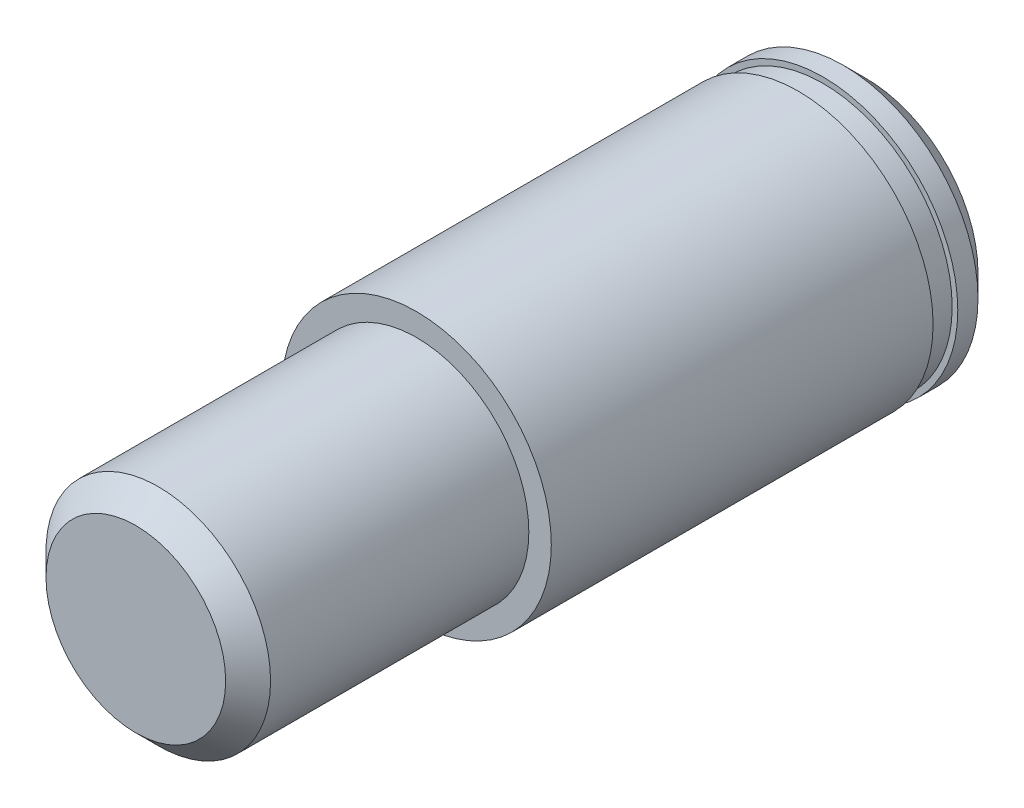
SolidWorks part; units mm, degrees
ref_plane "face" through (0, 0, 0) normal (0, 0, 1) x (1, 0, 0)
ref_plane "dessus" through (0, 0, 0) normal (0, 1, 0) x (1, 0, 0)
ref_plane "profil" through (0, 0, 0) normal (1, 0, 0) x (0, 0, -1)
sketch "Esquisse1" plane through (0, 0, 0) normal (0, 0, 1) x (1, 0, 0)
  circle A0 centre (0, 0) radius 6
  dimension "D1" = 12
extrude "Base-Extrusion" add sketch "Esquisse1" along normal blind 1.9
sketch "Esquisse2" plane through (0, 0, 1.9) normal (0, 0, 1) x (1, 0, 0)
  circle A0 centre (0, 0) radius 5.75
  dimension "D1" = 11.5
extrude "Boss.-Extru.1" add sketch "Esquisse2" along normal blind 1.1
sketch "Esquisse3" plane through (0, 0, 3) normal (0, 0, 1) x (1, 0, 0)
  circle A0 centre (0, 0) radius 6
  dimension "D1" = 12
extrude "Boss.-Extru.2" add sketch "Esquisse3" along normal blind 17
sketch "Esquisse4" plane through (0, 0, 20) normal (0, 0, 1) x (1, 0, 0)
  circle A0 centre (0, 0) radius 5
  dimension "D1" = 10
extrude "Boss.-Extru.3" add sketch "Esquisse4" along normal blind 12.5
chamfer "Chanfrein1" distance 1 angle 45
